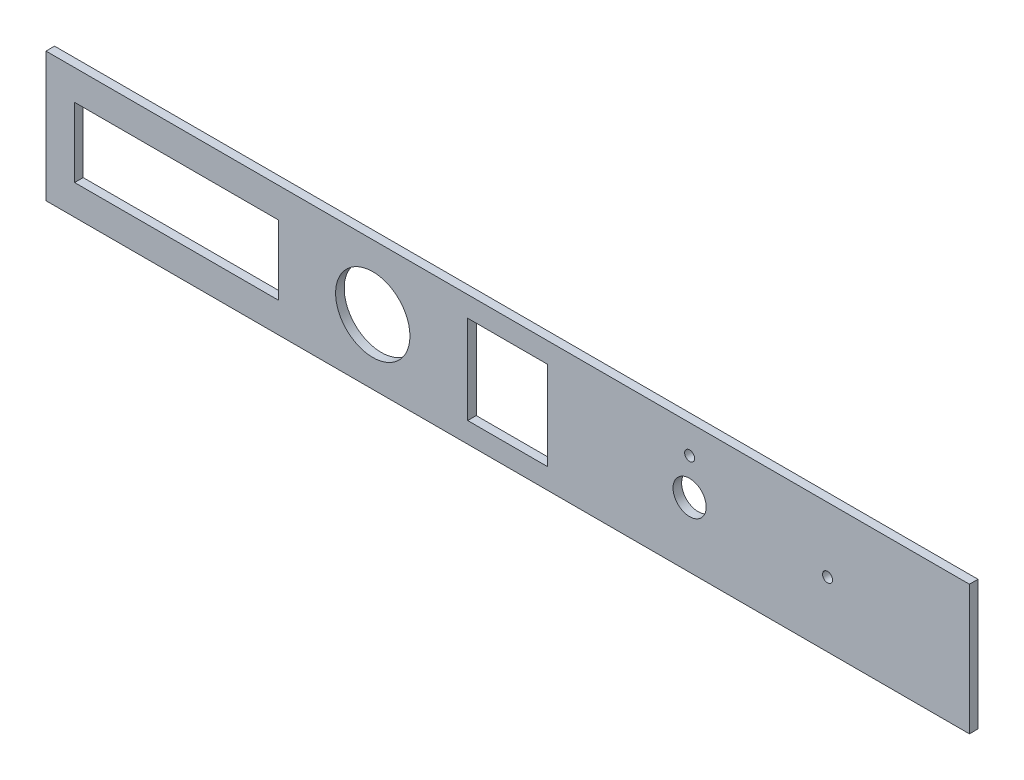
SolidWorks part; units mm, degrees
ref_plane "Front Plane" through (0, 0, 0) normal (0, 0, 1) x (1, 0, 0)
ref_plane "Top Plane" through (0, 0, 0) normal (0, 1, 0) x (1, 0, 0)
ref_plane "Right Plane" through (0, 0, 0) normal (1, 0, 0) x (0, 0, -1)
sketch "Sketch1" plane through (0, 0, 0) normal (0, 0, 1) x (1, 0, 0)
  line L1 (-161.5, 22.67) -> (161.5, 22.67)
  line L2 (-161.5, 22.67) -> (-161.5, -22.67)
  line L3 (-161.5, -22.67) -> (161.5, -22.67)
  line L4 (161.5, 22.67) -> (161.5, -22.67)
  line L5 (-161.5, 22.67) -> (161.5, -22.67) construction
  line L6 (-161.5, -22.67) -> (161.5, 22.67) construction
  point P0 (0, 0)
  dimension "D1" = 45.34
  dimension "D2" = 323
extrude "Boss-Extrude1" add sketch "Sketch1" along normal blind 3
sketch "Sketch2" plane through (0, 0, 3) normal (0, 0, 1) x (1, 0, 0)
  line L0 (-161.5, 22.67) -> (-161.5, -22.67) construction
  line L1 (-151.5, 12.15) -> (-80.2, 12.15)
  line L2 (-151.5, 12.15) -> (-151.5, -12.15)
  line L3 (-151.5, -12.15) -> (-80.2, -12.15)
  line L4 (-80.2, 12.15) -> (-80.2, -12.15)
  line L5 (-151.5, 12.15) -> (-80.2, -12.15) construction
  line L6 (-151.5, -12.15) -> (-80.2, 12.15) construction
  line L7 (161.5, 22.67) -> (-161.5, 22.67) construction
  line L8 (14, 0) -> (161.5, 0) construction
  line L9 (161.5, -22.67) -> (161.5, 22.67) construction
  line L11 (-14, 15.5) -> (14, 15.5)
  line L12 (-14, 15.5) -> (-14, -15.5)
  line L13 (-14, -15.5) -> (14, -15.5)
  line L14 (14, 15.5) -> (14, -15.5)
  line L15 (-14, 15.5) -> (14, -15.5) construction
  line L16 (-14, -15.5) -> (14, 15.5) construction
  circle A0 centre (-47.2, 0) radius 13
  circle A1 centre (63.625, 0) radius 5.8
  circle A2 centre (63.625, 12.67) radius 1.75
  circle A4 centre (111.875, 0) radius 1.75
  point P0 (-115.85, 0)
  point P25 (0, 0)
  dimension "D4" = 26
  dimension "D6" = 11.6
  dimension "D7" = 3.5
  dimension "D8" = 49.625
  dimension "D10" = 3.5
  dimension "D11" = 147.5
  dimension "D12" = 48.25
  dimension "D16" = 49.625
  dimension "D1" = 24.3
  dimension "D2" = 71.3
  dimension "D3" = 10
  dimension "D5" = 20
  dimension "D9" = 10
  dimension "D13" = 28
  dimension "D14" = 31
  dimension "D15" = 47.2
extrude "Cut-Extrude1" cut sketch "Sketch2" against normal through all both
